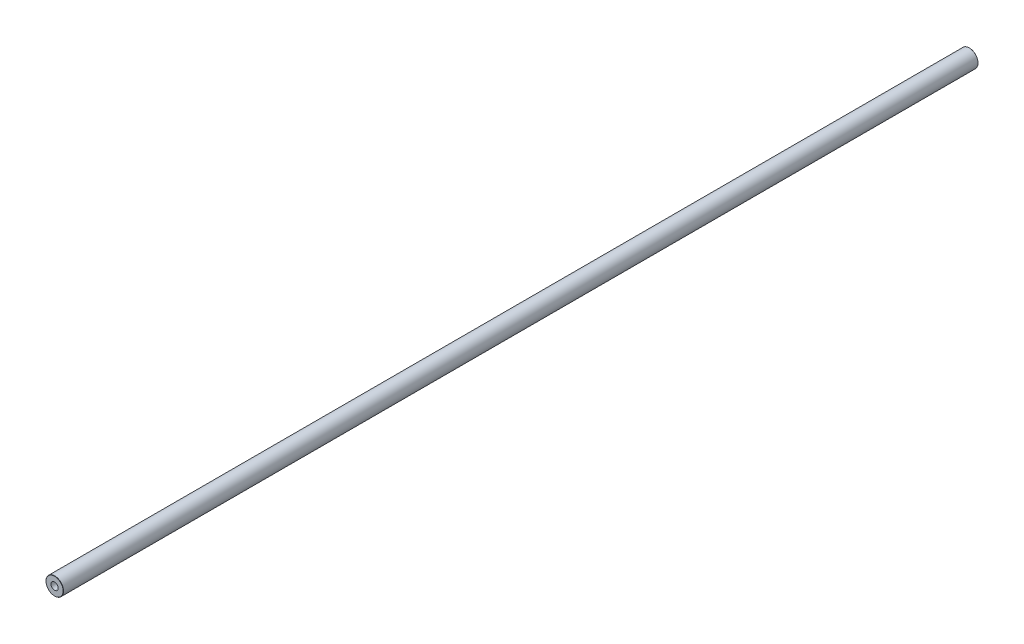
SolidWorks part; units mm, degrees
ref_plane "Plan de face" through (0, 0, 0) normal (0, 0, 1) x (1, 0, 0)
ref_plane "Plan de dessus" through (0, 0, 0) normal (0, 1, 0) x (1, 0, 0)
ref_plane "Plan de droite" through (0, 0, 0) normal (1, 0, 0) x (0, 0, -1)
sketch "Esquisse1" plane through (0, 0, 0) normal (0, 0, 1) x (1, 0, 0)
  circle A0 centre (0, 0) radius 4
  dimension "D1" = 8
extrude "Boss.-Extru.1" add sketch "Esquisse1" along normal blind 416.9
hole_wizard "Trou taraudé M4x0.71" positions "Esquisse4" profile "Esquisse5" tap size "M4x0.7" standard "Ansi Metric"
sketch "Esquisse4" plane through (0, 0, 0) normal (0, 0, -1) x (-1, 0, 0)
  point P0 (0, 0)
sketch "Esquisse5" plane through (0, 0, 0) normal (1, 0, 0) x (0, 1, 0)
  line L0 (0, 0) -> (0, 20.9914)
  line L1 (0, 20.9914) -> (1.65, 20)
  line L2 (1.65, 20) -> (1.65, 0)
  line L5 (1.65, 0) -> (0, 0)
  line L10 (0, 20.9914) -> (-1.65, 20) construction
  line L11 (0, -6.35) -> (0, 107.95) construction
  dimension "Diamètre du trou pour taraudage" = 3.3
  dimension "Profondeur du trou pour taraudage" = 20
  dimension "Angle de pointe" = 118
hole_wizard "Trou taraudé M4x0.72" positions "Esquisse7" profile "Esquisse6" tap size "M4x0.7" standard "Ansi Metric"
sketch "Esquisse7" plane through (0, 0, 416.9) normal (0, 0, 1) x (1, 0, 0)
  point P0 (0, 0)
sketch "Esquisse6" plane through (0, 0, 416.9) normal (1, 0, 0) x (0, -1, 0)
  line L0 (0, 0) -> (0, 20.9914)
  line L1 (0, 20.9914) -> (1.65, 20)
  line L2 (1.65, 20) -> (1.65, 0)
  line L5 (1.65, 0) -> (0, 0)
  line L10 (0, 20.9914) -> (-1.65, 20) construction
  line L11 (0, -6.35) -> (0, 107.95) construction
  dimension "Diamètre du trou pour taraudage" = 3.3
  dimension "Profondeur du trou pour taraudage" = 20
  dimension "Angle de pointe" = 118
chamfer "Chanfrein1" distance 0.1 angle 45 2 edges at (4, 0, 416.9) (4, 0, 0)
